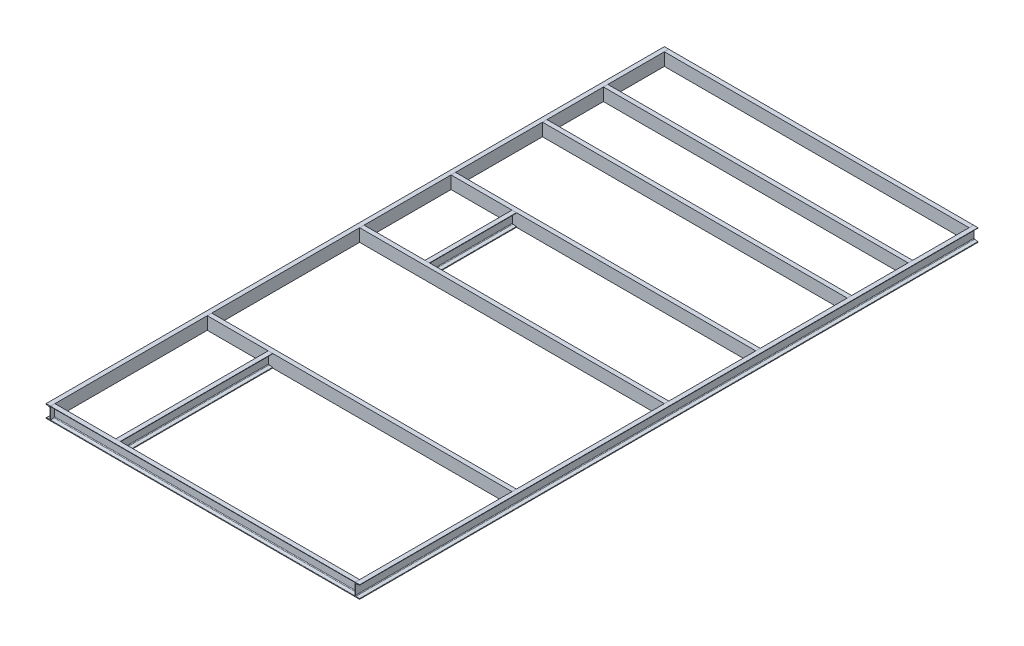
SolidWorks part; units mm, degrees
ref_plane "Front Plane" through (0, 0, 0) normal (0, 0, 1) x (1, 0, 0)
ref_plane "Top Plane" through (0, 0, 0) normal (0, 1, 0) x (1, 0, 0)
ref_plane "Right Plane" through (0, 0, 0) normal (1, 0, 0) x (0, 0, -1)
sketch "Sketch1" plane through (0, 0, 0) normal (0, 1, 0) x (1, 0, 0)
  line L0 (-1524, 2438.4) -> (1524, 2438.4)
  line L1 (-1524, -3048) -> (1524, -3048)
  line L2 (-1524, -3048) -> (-1524, 3048)
  line L3 (-1524, 3048) -> (1524, 3048)
  line L4 (1524, -3048) -> (1524, 3048)
  line L5 (-1524, -3048) -> (1524, 3048) construction
  line L6 (-1524, 3048) -> (1524, -3048) construction
  line L7 (1524, 1828.8) -> (-1524, 1828.8)
  line L8 (-1524, 0) -> (1524, 0)
  line L9 (-1524, -1524) -> (1524, -1524)
  line L10 (-1524, 914.4) -> (1524, 914.4)
  line L11 (-914.4, -1524) -> (-914.4, -3048)
  line L12 (-914.4, 914.4) -> (-914.4, 0)
  point P0 (0, 0)
  dimension "D1" = 6096
  dimension "D2" = 3048
  dimension "D3" = 609.6
  dimension "D4" = 609.6
  dimension "D5" = 914.4
  dimension "D6" = 914.4
  dimension "D7" = 1524
other "Structural Member1"
ref_plane "Plane1" through (-1524, 0, 3048) normal (0, 0, -1) x (-1, 0, 0)
sketch "Sketch11" plane through (-1524, 0, 3048) normal (0, 0, -1) x (-1, 0, 0)
  line L0 (0, -63.5) -> (0, 63.5)
  line L1 (0, 63.5) -> (44.45, 63.5)
  line L2 (0, -63.5) -> (44.45, -63.5)
  line L6 (0, 0) -> (4.826, 0) construction
  line L12 (4.826, 45.8301) -> (4.826, -45.8301)
  line L15 (44.45, 63.5) -> (44.45, 61.0413)
  line L16 (44.45, -63.5) -> (44.45, -61.0413)
  line L17 (10.981, 53.0959) -> (42.1154, 58.2853)
  line L18 (10.981, -53.0959) -> (42.1154, -58.2853)
  arc A9 (4.826, -45.8301) -> (10.981, -53.0959) centre (12.192, -45.8301) ccw
  arc A10 (4.826, 45.8301) -> (10.981, 53.0959) centre (12.192, 45.8301) cw
  arc A11 (44.45, 61.0413) -> (42.1154, 58.2853) centre (41.656, 61.0413) cw
  arc A12 (44.45, -61.0413) -> (42.1154, -58.2853) centre (41.656, -61.0413) ccw
  point P4 (44.45, 58.6744)
  point P5 (44.45, -58.6744)
  point P6 (2.413, 0)
  point P7 (22.225, 63.5)
  point P8 (0, 0)
  point P12 (22.225, -63.5)
  dimension "RI" = 7.366
  dimension "D2" = 9.463
  dimension "RA" = 2.794
  dimension "Depth" = 127
  dimension "BF" = 44.45
  dimension "TW" = 4.826
  dimension "flange" = 2.4587
